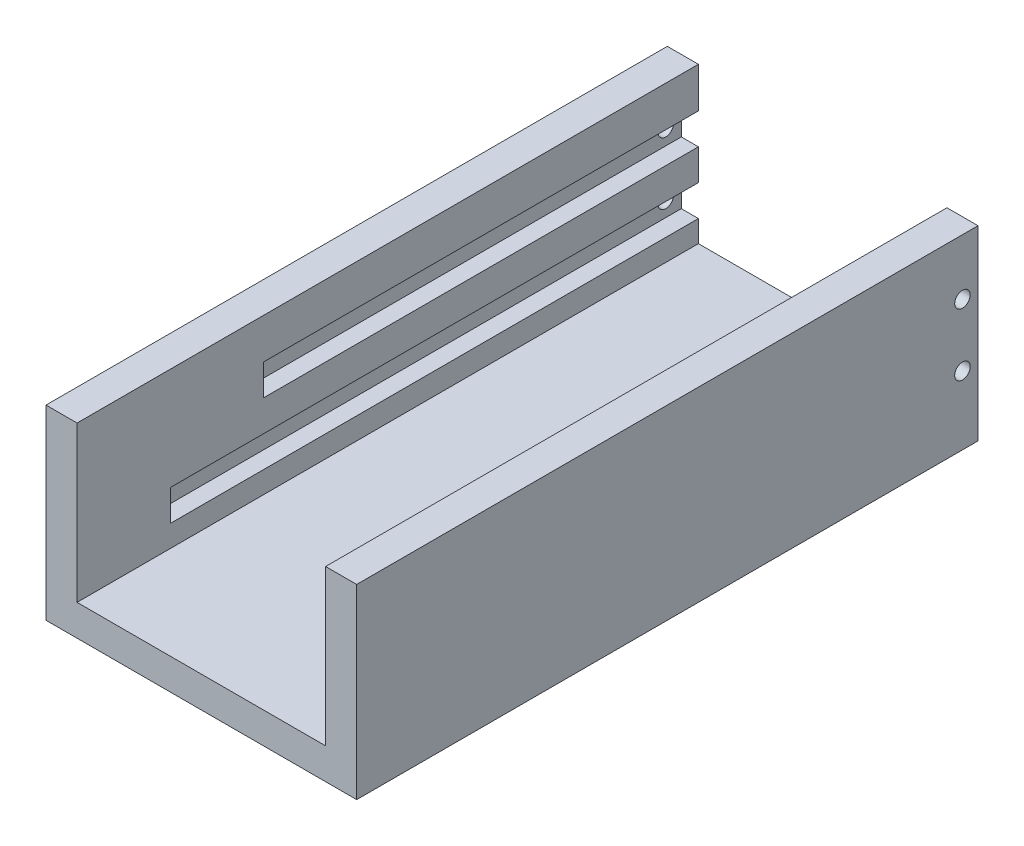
SolidWorks part; units mm, degrees
ref_plane "Front Plane" through (0, 0, 0) normal (0, 0, 1) x (1, 0, 0)
ref_plane "Top Plane" through (0, 0, 0) normal (0, 1, 0) x (1, 0, 0)
ref_plane "Right Plane" through (0, 0, 0) normal (1, 0, 0) x (0, 0, -1)
sketch "Sketch1" plane through (0, 0, 0) normal (0, 0, 1) x (1, 0, 0)
  line L0 (0, 0) -> (0, 61.6268) construction
  line L1 (50, 0) -> (-50, 0)
  line L2 (-50, 0) -> (-50, 60)
  line L3 (50, 0) -> (50, 60)
  dimension "D1" = 100
  dimension "D2" = 60
extrude "Extrude-Thin1" add sketch "Sketch1" along normal blind 200 thin
sketch "Sketch4" plane through (-40, 0, 0) normal (1, 0, 0) x (0, 0, -1)
  line L1 (0, 17) -> (-170, 17)
  line L3 (0, 27) -> (-170, 27)
  line L4 (-170, 17) -> (-170, 27)
  line L5 (0, 47) -> (0, 37)
  line L6 (0, 37) -> (-140, 37)
  line L7 (0, 27) -> (0, 17)
  line L8 (0, 47) -> (-140, 47)
  line L9 (-140, 37) -> (-140, 47)
  line L11 (0, 60) -> (0, 0) construction
  line L16 (-200, 10) -> (0, 10) construction
  dimension "D1" = 7
  dimension "D2" = 10
  dimension "D4" = 170
  dimension "D5" = 10
  dimension "D6" = 140
extrude "Cut-Extrude2" cut sketch "Sketch4" against normal blind 5.5
mirror "Mirror1" about plane through (0, 0, 0) normal (1, 0, 0) of "Cut-Extrude2"
sketch "Sketch5" plane through (50, 0, 0) normal (1, 0, 0) x (0, 0, -1)
  line L3 (-5, 47) -> (-5, 37) construction
  line L4 (0, 47) -> (-140, 47) construction
  line L5 (-140, 37) -> (0, 37) construction
  line L6 (-5, 27) -> (-5, 17) construction
  line L7 (0, 27) -> (-170, 27) construction
  line L8 (-170, 17) -> (0, 17) construction
  line L10 (0, 60) -> (0, 0) construction
  circle A0 centre (-5, 42) radius 2.5
  circle A2 centre (-5, 22) radius 2.5
  dimension "D2" = 5
  dimension "D1" = 5
extrude "Cut-Extrude3" cut sketch "Sketch5" against normal through all
